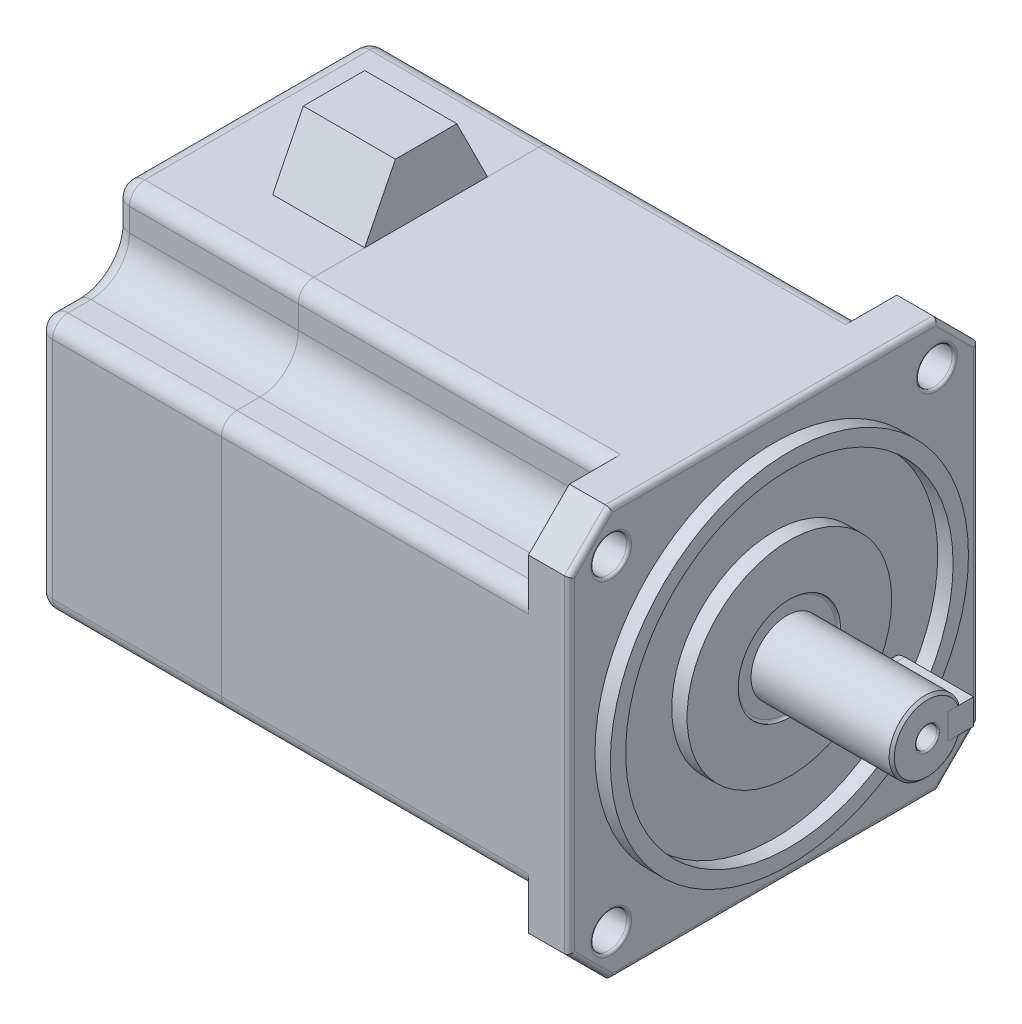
SolidWorks part; units mm, degrees
ref_plane "前视基准面" through (0, 0, 0) normal (0, 0, 1) x (1, 0, 0)
ref_plane "上视基准面" through (0, 0, 0) normal (0, 1, 0) x (1, 0, 0)
ref_plane "右视基准面" through (0, 0, 0) normal (1, 0, 0) x (0, 0, -1)
sketch "草图1" plane through (0, 0, 0) normal (1, 0, 0) x (0, 0, -1)
  line L0 (-40, 32) -> (-32, 40)
  line L1 (-32, -40) -> (32, -40)
  line L2 (-40, -32) -> (-40, 32)
  line L3 (-32, 40) -> (32, 40)
  line L4 (40, -32) -> (40, 32)
  line L5 (-40, -40) -> (40, 40) construction
  line L6 (-40, 40) -> (40, -40) construction
  line L7 (32, 40) -> (40, 32)
  line L8 (32, -40) -> (40, -32)
  line L9 (-40, -32) -> (-32, -40)
  point P0 (0, 0)
extrude "凸台-拉伸1" add sketch "草图1" against normal blind 68
sketch "草图2" plane through (-68, 0, 0) normal (-1, 0, 0) x (0, 0, 1)
  line L0 (-32, 40) -> (32, 40) construction
  line L1 (-32, -40) -> (32, -40)
  line L2 (-40, -32) -> (-40, 32)
  line L3 (-32, 40) -> (32, 40)
  line L4 (40, -32) -> (40, 32)
  line L5 (-40, -40) -> (40, 40) construction
  line L6 (-40, 40) -> (40, -40) construction
  line L7 (-40, 32) -> (-32, 40)
  line L8 (-32, -40) -> (-40, -32)
  line L9 (32, -40) -> (40, -32)
  line L10 (40, 32) -> (32, 40)
  point P0 (0, 0)
extrude "凸台-拉伸2" add sketch "草图2" along normal blind 36 separate body
sketch "草图3" plane through (-104, 0, 0) normal (-1, 0, 0) x (0, 0, 1)
  line L0 (-32.5, 24.9834) -> (-37, 24.9834)
  line L1 (-40, 32) -> (-40, -32) construction
  line L3 (-37, -24.9834) -> (-32.5, -24.9834)
  line L4 (-40, 21.9834) -> (-40, 32)
  line L5 (-24.9834, -32.5) -> (-24.9834, -37)
  line L6 (-32, -40) -> (32, -40) construction
  line L8 (24.9834, -37) -> (24.9834, -32.5)
  line L9 (-40, 32) -> (-32, 40)
  line L10 (32.5, -24.9834) -> (37, -24.9834)
  line L11 (40, -32) -> (40, 32) construction
  line L13 (37, 24.9834) -> (32.5, 24.9834)
  line L14 (-32, 40) -> (-21.9834, 40)
  line L15 (24.9834, 32.5) -> (24.9834, 37)
  line L16 (32, 40) -> (-32, 40) construction
  line L18 (-24.9834, 37) -> (-24.9834, 32.5)
  line L19 (21.9834, 40) -> (32, 40)
  line L20 (32, 40) -> (40, 32)
  line L21 (40, 32) -> (40, 21.9834)
  line L22 (40, -21.9834) -> (40, -32)
  line L23 (40, -32) -> (32, -40)
  line L24 (32, -40) -> (40, -32) construction
  line L25 (32, -40) -> (21.9834, -40)
  line L26 (-21.9834, -40) -> (-32, -40)
  line L27 (-32, -40) -> (-40, -32)
  line L28 (-40, -32) -> (-40, -21.9834)
  arc A0 (-32.5, 24.9834) -> (-24.9834, 32.5) centre (-32.5, 32.5) ccw
  arc A1 (24.9834, 32.5) -> (32.5, 24.9834) centre (32.5, 32.5) ccw
  arc A2 (32.5, -24.9834) -> (24.9834, -32.5) centre (32.5, -32.5) ccw
  arc A3 (-24.9834, -32.5) -> (-32.5, -24.9834) centre (-32.5, -32.5) ccw
  arc A4 (-40, 21.9834) -> (-37, 24.9834) centre (-37, 21.9834) cw
  arc A5 (-21.9834, 40) -> (-24.9834, 37) centre (-21.9834, 37) ccw
  arc A6 (21.9834, 40) -> (24.9834, 37) centre (21.9834, 37) cw
  arc A7 (37, 24.9834) -> (40, 21.9834) centre (37, 21.9834) cw
  arc A8 (40, -21.9834) -> (37, -24.9834) centre (37, -21.9834) cw
  arc A9 (24.9834, -37) -> (21.9834, -40) centre (21.9834, -37) cw
  arc A10 (-21.9834, -40) -> (-24.9834, -37) centre (-21.9834, -37) cw
  arc A11 (-37, -24.9834) -> (-40, -21.9834) centre (-37, -21.9834) cw
  point P0 (0, 0)
  point P10 (-40, 24.9834)
  point P38 (-24.9834, 40)
  point P41 (24.9834, 40)
  point P44 (40, 24.9834)
  point P47 (40, -24.9834)
  point P50 (24.9834, -40)
  point P53 (-24.9834, -40)
  point P56 (-40, -24.9834)
  dimension "D1" = 3
extrude "切除-拉伸1" cut sketch "草图3" against normal blind 96
sketch "草图4" plane through (0, 0, 0) normal (1, 0, 0) x (0, 0, -1)
  circle A1 centre (-31.8198, -31.8198) radius 3.5
  circle A2 centre (31.8198, -31.8198) radius 3.5
  circle A3 centre (31.8198, 31.8198) radius 3.5
  circle A4 centre (-31.8198, 31.8198) radius 3.5
extrude "切除-拉伸2" cut sketch "草图4" against normal blind 8
fillet "圆角1" radius 3 24 edges at (-104, 24.9834, -34.75) (-104, 27.1849, -27.1849) (-104, 34.75, -24.9834) (-104, 39.1213, -24.1047) (-104, 40, 0) (-104, 39.1213, 24.1047) (-104, 34.75, 24.9834) (-104, 27.1849, 27.1849) (-104, 24.9834, 34.75) (-104, 24.1047, 39.1213) (-104, 0, 40) (-104, -24.1047, 39.1213) (-104, -24.9834, 34.75) (-104, -27.1849, 27.1849) (-104, -34.75, 24.9834) (-104, -39.1213, 24.1047) (-104, -40, 0) (-104, -39.1213, -24.1047) (-104, -34.75, -24.9834) (-104, -27.1849, -27.1849) (-104, -24.9834, -34.75) (-104, -24.1047, -39.1213) (-104, 0, -40) (-104, 24.1047, -39.1213)
fillet "圆角2" radius 1 8 edges at (0, 36, -36) (0, 0, -40) (0, -36, -36) (0, -40, 0) (0, -36, 36) (0, 0, 40) (0, 36, 36) (0, 40, 0)
sketch "草图5" plane through (0, 0, 0) normal (1, 0, 0) x (0, 0, -1)
  circle A0 centre (0, 0) radius 35
  circle A1 centre (0, 0) radius 32
extrude "凸台-拉伸3" add sketch "草图5" along normal blind 3 separate body
sketch "草图6" plane through (0, 0, 0) normal (1, 0, 0) x (0, 0, -1)
  circle A0 centre (0, 0) radius 20
extrude "凸台-拉伸4" add sketch "草图6" along normal blind 3
sketch "草图7" plane through (3, 0, 0) normal (1, 0, 0) x (0, 0, -1)
  circle A0 centre (0, 0) radius 10
extrude "切除-拉伸3" cut sketch "草图7" against normal blind 0.5
fillet "圆角3" radius 0.5 1 edges at (2.5, 0, -10)
sketch "草图8" plane through (2.5, 0, 0) normal (1, 0, 0) x (0, 0, -1)
  circle A0 centre (0, 0) radius 7
extrude "凸台-拉伸5" add sketch "草图8" along normal blind 27.5
ref_plane "基准面1" through (0, 0, -7) normal (0, 0, 1) x (1, 0, 0)
sketch "草图9" plane through (0, 0, -7) normal (0, 0, 1) x (1, 0, 0)
  line L1 (30, -7) -> (30, 7) construction
  line L2 (16.5, 2.5) -> (30, 2.5)
  line L3 (30, 2.5) -> (30, -2.5)
  line L4 (30, -2.5) -> (16.5, -2.5)
  arc A0 (16.5, 2.5) -> (16.5, -2.5) centre (16.5, 0) ccw
extrude "切除-拉伸5" cut sketch "草图9" along normal blind 3
sketch "草图10" plane through (0, 0, -4) normal (0, 0, -1) x (-1, 0, 0)
  line L0 (-16.5, 2.5) -> (-30, 2.5)
  line L1 (-30, 2.5) -> (-30, -2.5)
  line L2 (-30, -2.5) -> (-16.5, -2.5)
  arc A0 (-16.5, -2.5) -> (-16.5, 2.5) centre (-16.5, 0) ccw
extrude "凸台-拉伸6" add sketch "草图10" along normal blind 5 separate body
chamfer "倒角1" distance 0.5 angle 45 1 edges at (30, 0, 7)
sketch "草图12" plane through (0, 40, 0) normal (0, 1, 0) x (1, 0, 0)
  line L4 (-86, -12) -> (-68, -12)
  line L5 (-86, -12) -> (-86, 12)
  line L6 (-86, 12) -> (-68, 12)
  line L7 (-68, -12) -> (-68, 12)
  line L8 (-86, -12) -> (-68, 12) construction
  line L9 (-86, 12) -> (-68, -12) construction
extrude "凸台-拉伸7" add sketch "草图12" along normal blind 12 separate body
sketch "草图16" plane through (-68, 0, 0) normal (1, 0, 0) x (0, 0, -1)
  line L0 (-12, 40) -> (-12, 52)
  line L1 (-12, 52) -> (-6, 52)
  line L2 (-12, 52) -> (12, 52) construction
  line L3 (12, 40) -> (12, 52)
  line L4 (12, 52) -> (6, 52)
  line L5 (-6, 52) -> (-12, 40)
  line L6 (6, 52) -> (12, 40)
extrude "切除-拉伸7" cut sketch "草图16" against normal blind 18
hole_wizard "M5 螺纹孔2" positions "草图18" profile "草图17" tap size "M5" standard "GB"
sketch "草图18" plane through (30, 0, 0) normal (1, 0, 0) x (0, 0, -1)
  point P0 (0, 0)
sketch "草图17" plane through (30, 0, 0) normal (0, 1, 0) x (0, 0, -1)
  line L0 (0, 0) -> (0, 9.2618)
  line L1 (0, 9.2618) -> (2.1, 8)
  line L2 (2.1, 8) -> (2.1, 0)
  line L5 (2.1, 0) -> (0, 0)
  line L10 (0, 9.2618) -> (-2.1, 8) construction
  line L11 (0, -6.35) -> (0, 107.95) construction
  dimension "螺纹孔钻头直径" = 4.2
  dimension "螺纹孔钻头深度" = 8
  dimension "导头角度" = 118
fillet "圆角4" radius 0.5 4 edges at (0, -31.8198, 28.3198) (0, -31.8198, -35.3198) (0, 31.8198, -35.3198) (0, 31.8198, 28.3198)
fillet "圆角5" radius 0.3 1 edges at (30, 0, -2.1)
hole_wizard "M5 螺纹孔1" positions "草图15" profile "草图14" tap size "M5" standard "GB"
sketch "草图15" plane through (30, 0, 0) normal (1, 0, 0) x (0, 0, -1)
  point P0 (0, 0)
sketch "草图14" plane through (30, 0, 0) normal (0, 1, 0) x (0, 0, -1)
  line L0 (0, 0) -> (0, 9.2618)
  line L1 (0, 9.2618) -> (2.1, 8)
  line L2 (2.1, 8) -> (2.1, 0)
  line L5 (2.1, 0) -> (0, 0)
  line L10 (0, 9.2618) -> (-2.1, 8) construction
  line L11 (0, -6.35) -> (0, 107.95) construction
  dimension "螺纹孔钻头直径" = 4.2
  dimension "螺纹孔钻头深度" = 8
  dimension "导头角度" = 118
